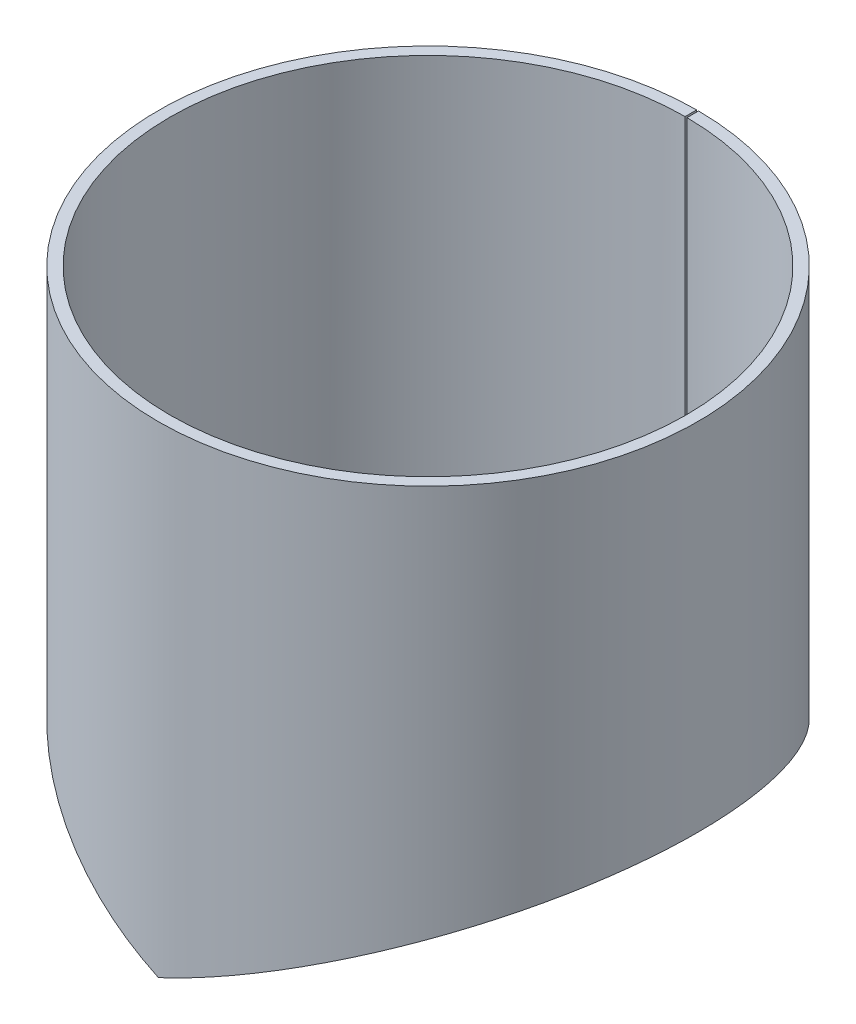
SolidWorks part; units mm, degrees
ref_plane "前视基准面" through (0, 0, 0) normal (0, 0, 1) x (1, 0, 0)
ref_plane "上视基准面" through (0, 0, 0) normal (0, 1, 0) x (1, 0, 0)
ref_plane "右视基准面" through (0, 0, 0) normal (1, 0, 0) x (0, 0, -1)
imported_body "基体零件-等径裤形管-1"
sheet metal parameters "钣金1" parameters "D1"=0.7366, "厚度"=6
bend "圆角折弯1" bend radius 134 bend angle 359.591 parameters "D5"=1
flatten bends "展开-折弯1" parameters "D1"=0
sketch "尖角-草图1" plane through (0.5, 125.1166, -139.9991) normal (0.0036, 0, -1) x (-1, 0, -0.0036)
  line L0 (-420.4948, -124.8834) -> (-420.4948, 124.8834) construction
process bends "加工-折弯1" parameters "D1"=0
sketch "平面-草图1" plane through (0.5, 125.1166, -139.9991) normal (0.0036, 0, -1) x (-1, 0, -0.0036)
